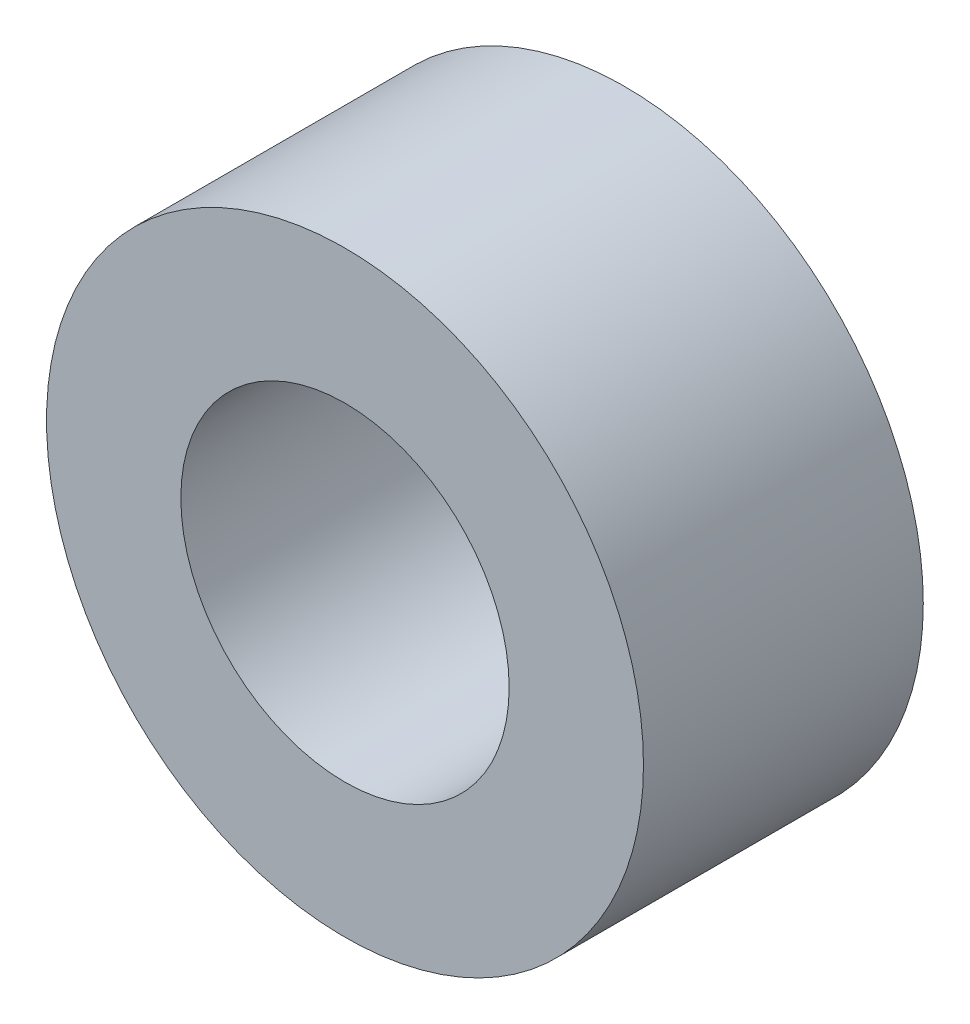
SolidWorks part; units mm, degrees
ref_plane "Front Plane" through (0, 0, 0) normal (0, 0, 1) x (1, 0, 0)
ref_plane "Top Plane" through (0, 0, 0) normal (0, 1, 0) x (1, 0, 0)
ref_plane "Right Plane" through (0, 0, 0) normal (1, 0, 0) x (0, 0, -1)
sketch "Sketch1" plane through (0, 0, 0) normal (0, 0, 1) x (1, 0, 0)
  circle A0 centre (0, 0) radius 8
  dimension "D1" = 16
extrude "Boss-Extrude2" add sketch "Sketch1" along normal blind 7.5
hole_wizard "M10x1.25 Tapped Hole1" positions "3DSketch1" profile "Sketch2" tap size "M10x1.25" standard "ISO"
sketch3d "3DSketch1"
  line L2 (0, 0, 7.5) -> (8, 0, 7.5) construction
  line L4 (0, 0, 7.5) -> (0, -8, 7.5) construction
  circle A0 centre (0, 0, 7.5) radius 8 construction
  point P0 (0, 0, 7.5)
  point P7 (0, 0, 15.5)
  dimension "D1" = 8
  dimension "D2" = 8
sketch "Sketch2" plane through (0, 0, 7.5) normal (1, 0, 0) x (0, -1, 0)
  line L0 (0, 0) -> (0, 7.5)
  line L1 (0, 7.5) -> (4.4, 7.5)
  line L2 (4.4, 7.5) -> (4.4, 0)
  line L5 (4.4, 0) -> (0, 0)
  line L11 (0, -6.35) -> (0, 107.95) construction
  dimension "Thru Tap Drill Dia." = 8.8
  dimension "Thru Tap Drill Depth" = 7.5
